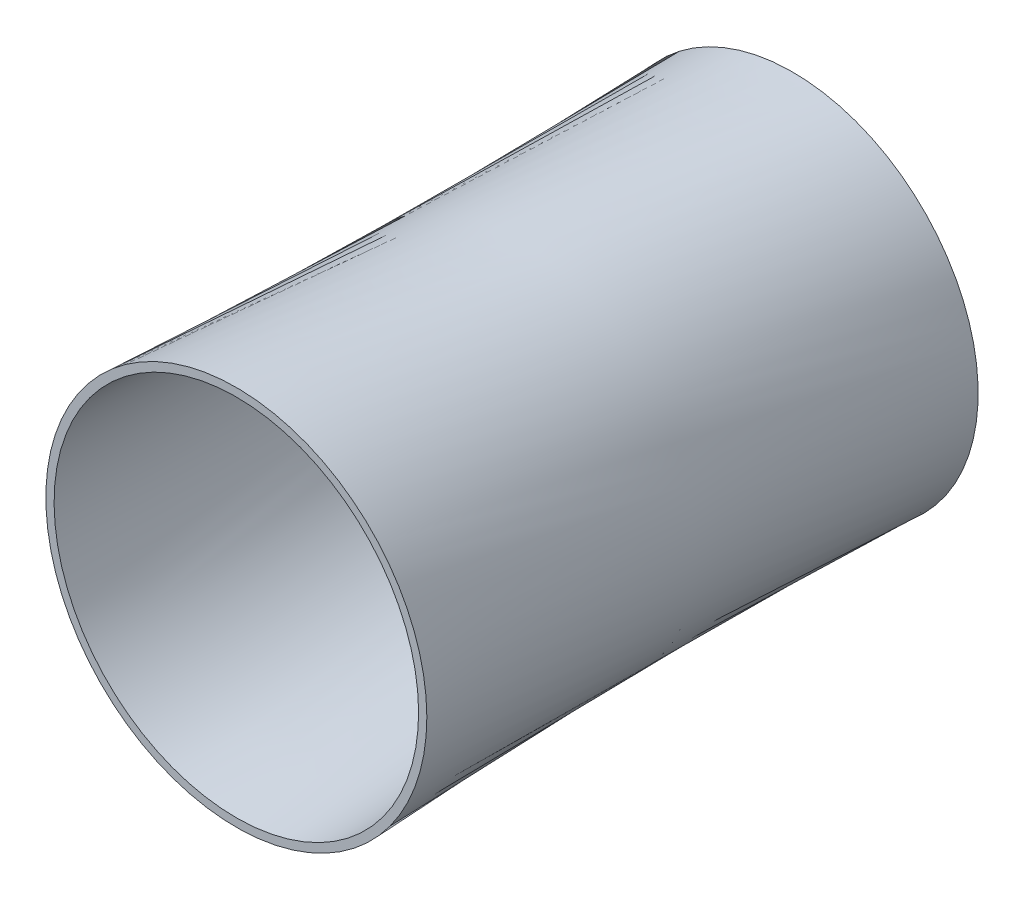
SolidWorks part; units mm, degrees
ref_plane "Front Plane" through (0, 0, 0) normal (0, 0, 1) x (1, 0, 0)
ref_plane "Top Plane" through (0, 0, 0) normal (0, 1, 0) x (1, 0, 0)
ref_plane "Right Plane" through (0, 0, 0) normal (1, 0, 0) x (0, 0, -1)
body saved out of another part "Stock-Second Layer Sleeve-1"
